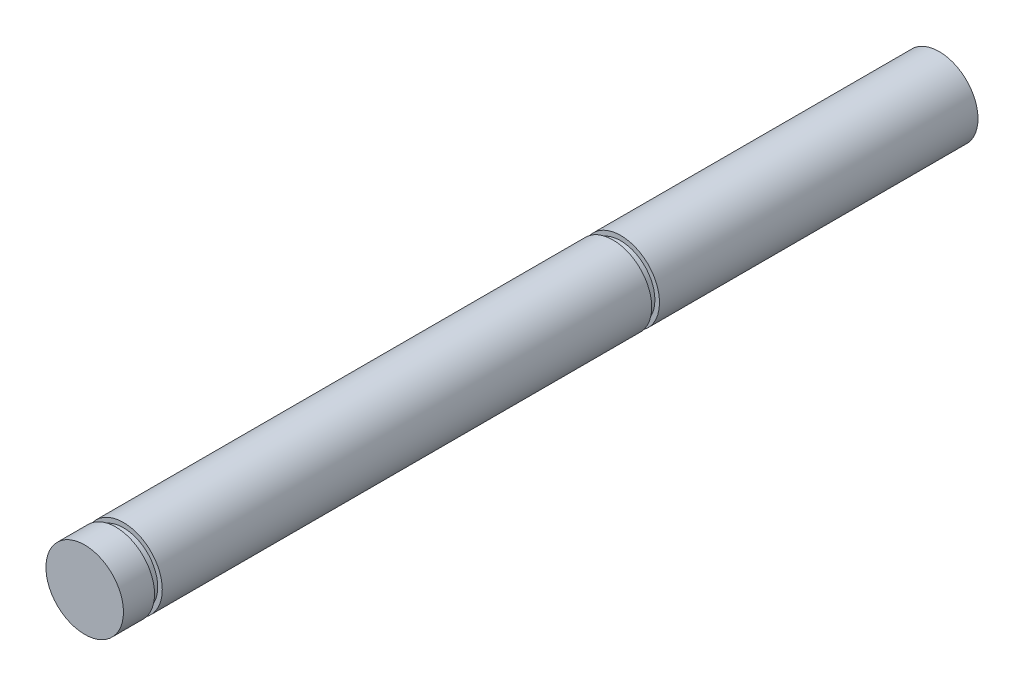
SolidWorks part; units mm, degrees
ref_plane "Front" through (0, 0, 0) normal (0, 0, 1) x (1, 0, 0)
ref_plane "Top" through (0, 0, 0) normal (0, 1, 0) x (1, 0, 0)
ref_plane "Right" through (0, 0, 0) normal (1, 0, 0) x (0, 0, -1)
sketch "Sketch1" plane through (0, 0, 0) normal (0, 0, 1) x (1, 0, 0)
  circle A0 centre (0, 0) radius 3.1686
  dimension "D1" = 6.3373
extrude "Extrude1" add sketch "Sketch1" along normal mid plane 69.85
sketch "Sketch2" plane through (0, 0, 0) normal (0, 1, 0) x (1, 0, 0)
  line L0 (0, 0) -> (0, 26.2284) construction
  line L1 (-3.1686, -34.925) -> (3.1686, -34.925) construction
  line L2 (29.7516, 8.89) -> (2.794, 8.89)
  line L3 (29.7516, 8.89) -> (29.7516, 8.255)
  line L4 (29.7516, 8.255) -> (2.794, 8.255)
  line L5 (2.794, 8.89) -> (2.794, 8.255)
  line L6 (2.794, -31.75) -> (2.794, -32.385)
  line L7 (29.7516, -32.385) -> (2.794, -32.385)
  line L8 (29.7516, -31.877) -> (29.7516, -32.385)
  line L9 (29.7516, -31.877) -> (2.794, -31.75)
  dimension "D1" = 40.64
  dimension "D2" = 5.588
  dimension "D3" = 0.635
  dimension "D4" = 2.54
revolve "Cut-Revolve1" cut sketch "Sketch2" angle 360 about L0
